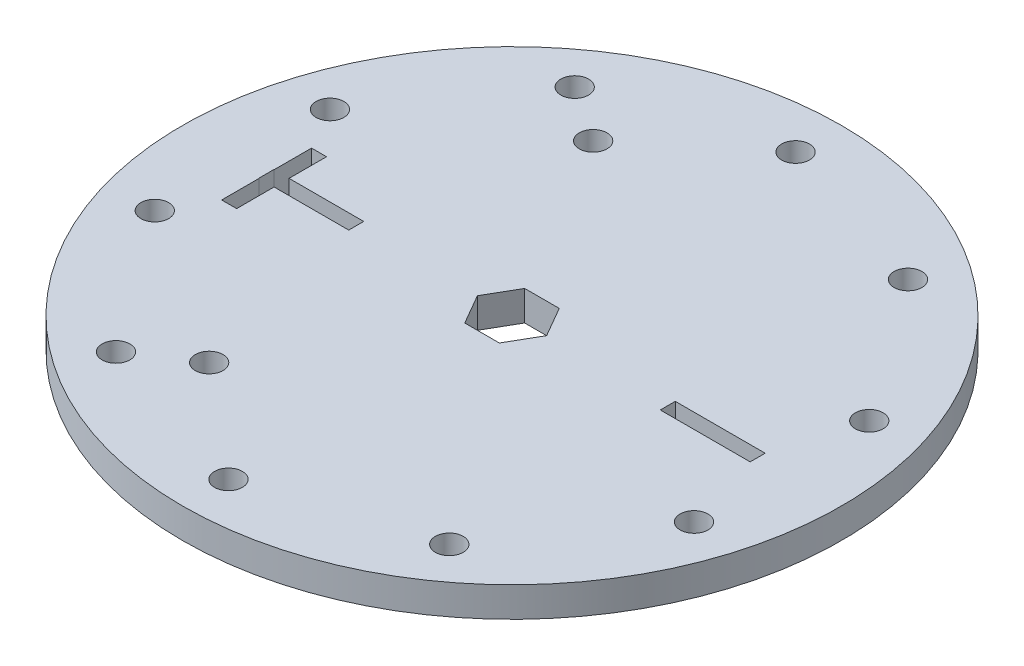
SolidWorks part; units mm, degrees
ref_plane "Front Plane" through (0, 0, 0) normal (0, 0, 1) x (1, 0, 0)
ref_plane "Top Plane" through (0, 0, 0) normal (0, 1, 0) x (1, 0, 0)
ref_plane "Right Plane" through (0, 0, 0) normal (1, 0, 0) x (0, 0, -1)
sketch "Sketch1" plane through (0, 0, 0) normal (0, 1, 0) x (1, 0, 0)
  line L1 (1.8331, 3.175) -> (-1.8331, 3.175)
  line L2 (-1.8331, 3.175) -> (-3.6662, 0)
  line L3 (-3.6662, 0) -> (-1.8331, -3.175)
  line L4 (-1.8331, -3.175) -> (1.8331, -3.175)
  line L5 (1.8331, -3.175) -> (3.6662, 0)
  line L6 (3.6662, 0) -> (1.8331, 3.175)
  circle A0 centre (0, 0) radius 34.925
  circle A1 centre (0, 0) radius 3.175 construction
  dimension "D1" = 69.85
  dimension "D2" = 6.35
extrude "Boss-Extrude1" add sketch "Sketch1" along normal blind 3.175
hole_wizard "#4 Clearance Hole1" positions "Sketch4" profile "Sketch2" hole size "#4" standard "ANSI Inch"
sketch "Sketch4" plane through (0, 3.175, 0) normal (0, 1, 0) x (1, 0, 0)
  line L1 (0, 30.0455) -> (-17.6603, 24.3073) construction
  line L2 (-17.6603, 24.3073) -> (-28.575, 9.2846) construction
  line L3 (-28.575, 9.2846) -> (-28.575, -9.2846) construction
  line L4 (-28.575, -9.2846) -> (-17.6603, -24.3073) construction
  line L5 (-17.6603, -24.3073) -> (0, -30.0455) construction
  line L6 (0, -30.0455) -> (17.6603, -24.3073) construction
  line L7 (17.6603, -24.3073) -> (28.575, -9.2846) construction
  line L8 (28.575, -9.2846) -> (28.575, 9.2846) construction
  line L9 (28.575, 9.2846) -> (17.6603, 24.3073) construction
  line L10 (17.6603, 24.3073) -> (0, 30.0455) construction
  line L12 (0, 0) -> (28.575, 9.2846) construction
  line L20 (34.925, 0) -> (0, 0) construction
  circle A0 centre (0, 0) radius 28.575 construction
  circle A1 centre (0, 0) radius 34.925 construction
  point P3 (0, 30.0455)
  point P4 (-17.6603, 24.3073)
  point P5 (-28.575, 9.2846)
  point P6 (-28.575, -9.2846)
  point P7 (-17.6603, -24.3073)
  point P8 (0, -30.0455)
  point P9 (17.6603, -24.3073)
  point P10 (28.575, -9.2846)
  point P11 (28.575, 9.2846)
  point P12 (17.6603, 24.3073)
  dimension "D1" = 57.15
  dimension "D2" = 18
sketch "Sketch2" plane through (0, 3.175, -30.0455) normal (1, 0, 0) x (0, 0, 1)
  line L0 (0, 0) -> (0, 3.175)
  line L1 (0, 3.175) -> (1.4732, 3.175)
  line L2 (1.4732, 3.175) -> (1.4732, 0)
  line L5 (1.4732, 0) -> (0, 0)
  line L11 (0, -6.35) -> (0, 107.95) construction
  dimension "Thru Hole Dia." = 2.9464
  dimension "Thru Hole Depth" = 3.175
hole_wizard "#4 Clearance Hole4" positions "Sketch9" profile "Sketch8" hole size "#4" standard "ANSI Inch"
sketch "Sketch9" plane through (0, 3.175, 0) normal (0, 1, 0) x (1, 0, 0)
  line L0 (0, 0) -> (-11.7475, 0) construction
  line L1 (-11.7475, 20.3473) -> (-11.7475, -20.3473) construction
  line L2 (0, 0) -> (-11.7475, 20.3473) construction
  line L3 (0, 0) -> (-11.7475, -20.3473) construction
  point P5 (-11.7475, 20.3473)
  point P6 (-11.7475, -20.3473)
  point P14 (-11.7475, 0)
  dimension "D1" = 120
  dimension "D2" = 23.495
sketch "Sketch8" plane through (-11.7475, 3.175, -20.3473) normal (1, 0, 0) x (0, 0, 1)
  line L0 (0, 0) -> (0, 3.175)
  line L1 (0, 3.175) -> (1.4732, 3.175)
  line L2 (1.4732, 3.175) -> (1.4732, 0)
  line L5 (1.4732, 0) -> (0, 0)
  line L11 (0, -6.35) -> (0, 107.95) construction
  dimension "Thru Hole Dia." = 2.9464
  dimension "Thru Hole Depth" = 3.175
sketch "Sketch5" plane through (0, 3.175, 0) normal (0, 1, 0) x (1, 0, 0)
  line L0 (-34.925, 0) -> (34.925, 0) construction
  line L1 (0, 3.175) -> (0, -3.175) construction
  line L2 (-26.035, 0.7937) -> (-16.51, 0.7937)
  line L3 (-26.035, 0.7937) -> (-26.035, -0.7938)
  line L4 (-26.035, -0.7938) -> (-16.51, -0.7937)
  line L5 (-16.51, 0.7937) -> (-16.51, -0.7937)
  line L6 (1.8331, 3.175) -> (-1.8331, 3.175) construction
  line L7 (-1.8331, -3.175) -> (1.8331, -3.175) construction
  line L8 (16.51, 0.7937) -> (16.51, -0.7937)
  line L9 (26.035, -0.7937) -> (16.51, -0.7937)
  line L10 (26.035, 0.7937) -> (26.035, -0.7937)
  line L11 (26.035, 0.7937) -> (16.51, 0.7937)
  circle A0 centre (0, 0) radius 34.925 construction
  point P10 (-16.51, 0)
  dimension "D1" = 9.525
  dimension "D2" = 1.5875
  dimension "D3" = 8.89
extrude "Cut-Extrude1" cut sketch "Sketch5" against normal through all
sketch "Sketch10" plane through (0, 3.175, 0) normal (0, 1, 0) x (1, 0, 0)
  line L0 (-16.51, -0.7937) -> (-16.51, 0.7937) construction
  line L1 (-26.0056, 4.7625) -> (-24.4181, 4.7625)
  line L2 (-26.0056, 4.7625) -> (-26.0056, -4.7625)
  line L3 (-26.0056, -4.7625) -> (-24.4181, -4.7625)
  line L4 (-24.4181, 4.7625) -> (-24.4181, -4.7625)
  line L5 (-16.51, 0.7937) -> (-26.035, 0.7937) construction
  point P4 (-24.4181, 0)
extrude "Cut-Extrude2" cut sketch "Sketch10" against normal through all
hole_wizard "#4 Clearance Hole5" positions "Sketch12" profile "Sketch11" hole size "#4" standard "ANSI Inch"
sketch "Sketch12" plane through (0, 3.175, 0) normal (0, 1, 0) x (1, 0, 0)
  line L0 (0, 0) -> (30.0455, 0) construction
  line L2 (0, 0) -> (28.575, 9.2846) construction
  point P0 (30.0455, 0)
  point P18 (24.3073, -17.6603)
  point P19 (9.2846, -28.575)
  point P20 (-9.2846, -28.575)
  point P21 (-24.3073, -17.6603)
  point P22 (-30.0455, 0)
  point P23 (-24.3073, 17.6603)
  point P24 (-9.2846, 28.575)
  point P25 (9.2846, 28.575)
  point P26 (24.3073, 17.6603)
  point P27 (0, 0)
  dimension "D1" = 18
  dimension "D2" = 10
sketch "Sketch11" plane through (30.0455, 3.175, 0) normal (1, 0, 0) x (0, 0, 1)
  line L0 (0, 0) -> (0, 3.175)
  line L1 (0, 3.175) -> (1.4732, 3.175)
  line L2 (1.4732, 3.175) -> (1.4732, 0)
  line L5 (1.4732, 0) -> (0, 0)
  line L11 (0, -6.35) -> (0, 107.95) construction
  dimension "Thru Hole Dia." = 2.9464
  dimension "Thru Hole Depth" = 3.175
